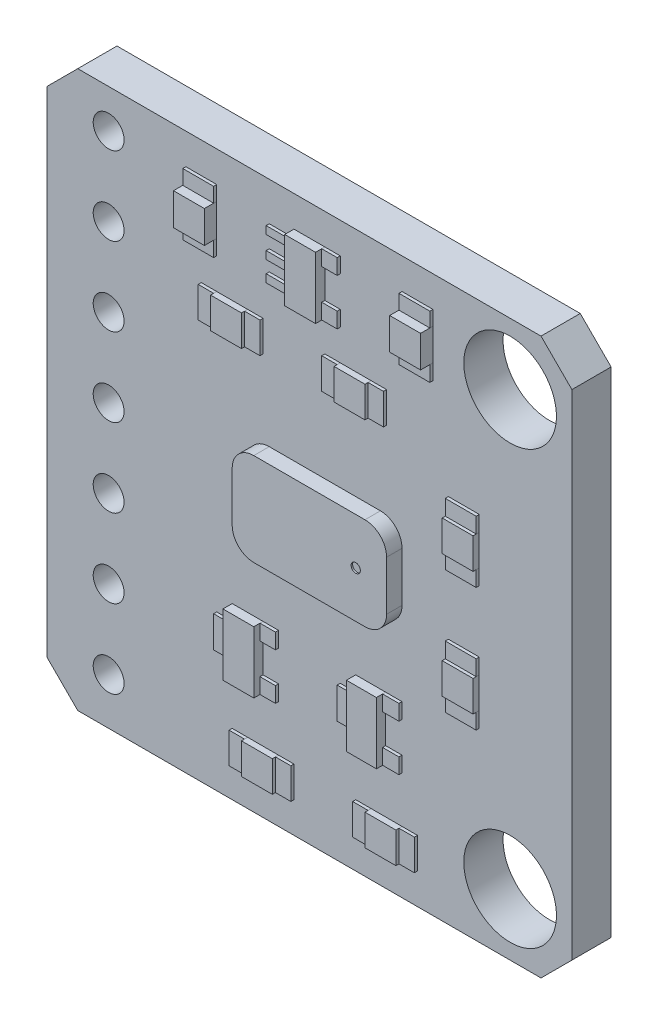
SolidWorks part; units mm, degrees
ref_plane "Front Plane" through (0, 0, 0) normal (0, 0, 1) x (1, 0, 0)
ref_plane "Top Plane" through (0, 0, 0) normal (0, 1, 0) x (1, 0, 0)
ref_plane "Right Plane" through (0, 0, 0) normal (1, 0, 0) x (0, 0, -1)
imported_body "MPL3115A2 barometric altimeter.step<1>"
sketch "Sketch1" plane through (0, 0, 0) normal (0, 0, 1) x (1, 0, 0)
  line L0 (2, 18) -> (2, 0) construction
  line L1 (16, 18) -> (1, 18) construction
  line L2 (1, 0) -> (16, 0) construction
  line L3 (0, 17) -> (0, 1) construction
  circle A0 centre (2, 16.75) radius 0.5
  circle A1 centre (2, 14.21) radius 0.5
  circle A2 centre (2, 11.67) radius 0.5
  circle A3 centre (2, 9.13) radius 0.5
  circle A4 centre (2, 6.59) radius 0.5
  circle A5 centre (2, 4.05) radius 0.5
  circle A6 centre (2, 1.51) radius 0.5
  dimension "D1" = 1
  dimension "D2" = 2
  dimension "D3" = 1.25
  dimension "D4" = 7
extrude "Cut-Extrude1" cut sketch "Sketch1" against normal through all
